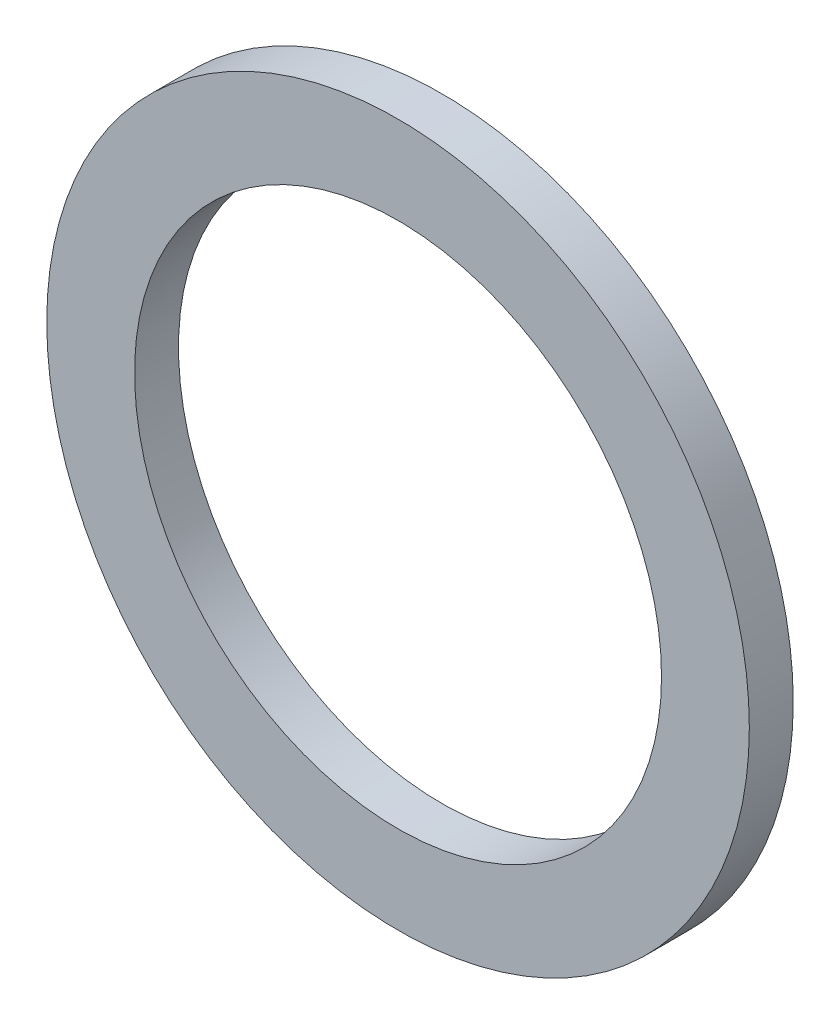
SolidWorks part; units mm, degrees
ref_plane "Plan de face" through (0, 0, 0) normal (0, 0, 1) x (1, 0, 0)
ref_plane "Plan de dessus" through (0, 0, 0) normal (0, 1, 0) x (1, 0, 0)
ref_plane "Plan de droite" through (0, 0, 0) normal (1, 0, 0) x (0, 0, -1)
sketch "Esquisse1" plane through (0, 0, 0) normal (0, 0, 1) x (1, 0, 0)
  circle A0 centre (0, 0) radius 6
  circle A1 centre (0, 0) radius 8
  dimension "D1" = 12
  dimension "D2" = 16
extrude "Boss.-Extru.1" add sketch "Esquisse1" against normal blind 1
